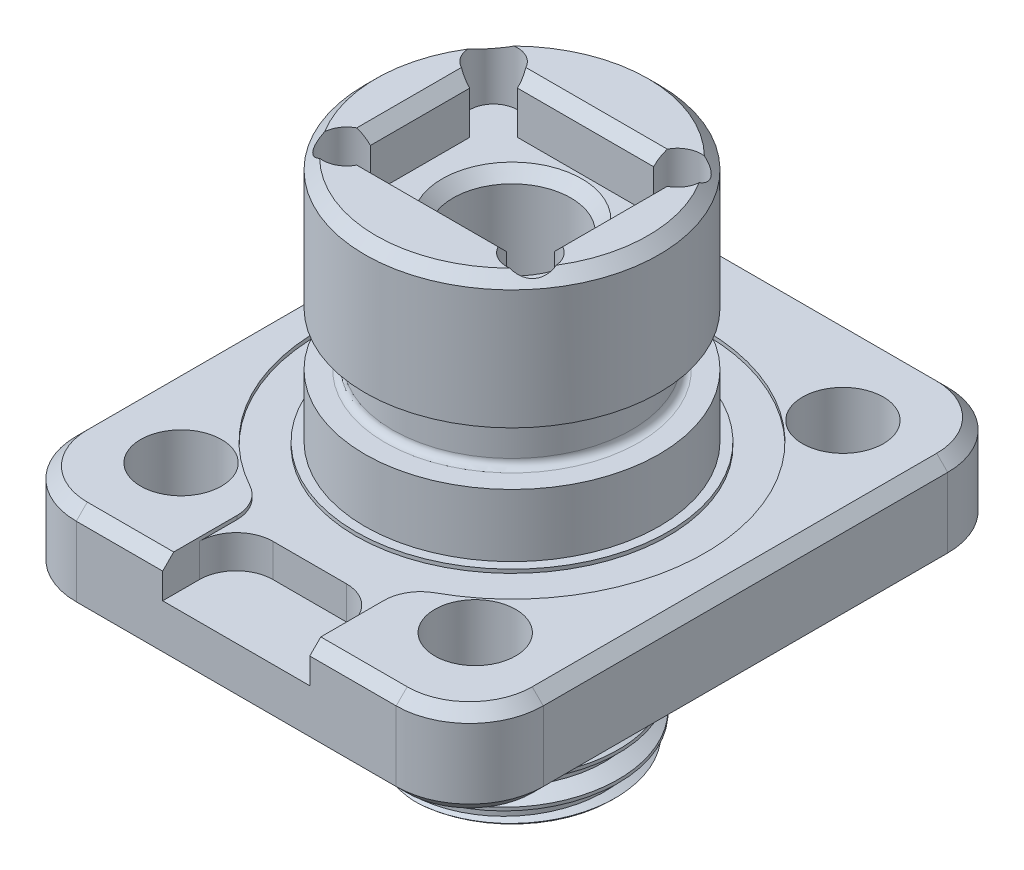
SolidWorks part; units mm, degrees
ref_plane "前视基准面" through (0, 0, 0) normal (0, 0, 1) x (1, 0, 0)
ref_plane "上视基准面" through (0, 0, 0) normal (0, 1, 0) x (1, 0, 0)
ref_plane "右视基准面" through (0, 0, 0) normal (1, 0, 0) x (0, 0, -1)
sketch "草图1" plane through (0, 0, 0) normal (1, 0, 0) x (0, 0, -1)
  line L0 (0, 0) -> (0, 4.5353) construction
  line L1 (-0.75, 0) -> (-1.6, 0)
  line L2 (-1.6, 0) -> (-1.6, -4)
  line L3 (-1.6, -4) -> (-2.1, -5)
  line L4 (-2.1, -5) -> (-3, -5)
  line L5 (-3, -5) -> (-3, -1.7)
  line L6 (-3, -1.7) -> (-2.5, -1.7)
  line L7 (-2.5, -1.7) -> (-2.5, -0.7)
  line L8 (-2.5, -0.7) -> (-5.4, -0.7)
  line L9 (-5.4, -0.7) -> (-5.4, 1)
  line L16 (-4, 1) -> (-1.25, 1)
  line L17 (-1.25, 1) -> (-0.75, 0.5)
  line L18 (-0.75, 0.5) -> (-0.75, 0)
  line L24 (-4, 1) -> (-5.4, 1)
  dimension "D1" = 0.75
  dimension "D2" = 0.5
  dimension "D3" = 1
  dimension "D4" = 45
  dimension "D5" = 1.6
  dimension "D6" = 3
  dimension "D7" = 5
  dimension "D8" = 1
  dimension "D9" = 0.5
  dimension "D10" = 0.7
  dimension "D11" = 3.3
  dimension "D12" = 0.5
  dimension "D13" = 5.4
revolve "旋转1" add sketch "草图1" angle 360 about L0
sketch "草图7" plane through (0, -0.7, 0) normal (0, 1, 0) x (1, 0, 0)
  line L0 (-6.35, 5.5) -> (-6.35, -5.5)
  line L1 (-4.35, -7.5) -> (4.35, -7.5)
  line L2 (6.35, -5.5) -> (6.35, 5.5)
  line L3 (4.35, 7.5) -> (-4.35, 7.5)
  line L4 (0, 0) -> (0, -4.1519) construction
  line L5 (0, 0) -> (-4.2498, 0) construction
  arc A0 (-6.35, -5.5) -> (-4.35, -7.5) centre (-4.35, -5.5) ccw
  arc A1 (4.35, -7.5) -> (6.35, -5.5) centre (4.35, -5.5) ccw
  arc A4 (6.35, 5.5) -> (4.35, 7.5) centre (4.35, 5.5) ccw
  arc A5 (-4.35, 7.5) -> (-6.35, 5.5) centre (-4.35, 5.5) ccw
  point P0 (0, 0)
  dimension "D1" = 2
  dimension "D2" = 15
  dimension "D4" = 12.7
extrude "凸台-拉伸1" add sketch "草图7" along normal blind 2
hole_wizard "M2 间隙槽口6" positions "草图8" profile "草图9" size "M2" standard "GB"
sketch "草图8" plane through (0, -0.7, 0) normal (0, -1, 0) x (-1, 0, 0)
  line L4 (0, 0) -> (0, 4.7467) construction
  line L6 (0, 0) -> (-5.268, 0) construction
  point P0 (-4, -5)
  point P2 (4, -5)
  point P6 (-4, 5)
  point P45 (4, 5)
  dimension "D1" = 10
  dimension "D2" = 8
sketch "草图9" plane through (4, -0.7, 5) normal (1, 0, 0) x (0, 0, -1)
  line L0 (0, 0) -> (0, 2)
  line L1 (0, 2) -> (1.1, 2)
  line L2 (1.1, 2) -> (1.1, 0)
  line L5 (1.1, 0) -> (0, 0)
  line L11 (0, -6.35) -> (0, 107.95) construction
  dimension "通孔孔直径" = 2.2
  dimension "通孔孔深度" = 2
chamfer "倒角1" distance 0.3 angle 45 1 edges at (0, -5, -3)
thread "螺纹线2" pitch 0.7 start angle 0, offset 1, length 3.6, pitch 0.7, diameter 6
ref_plane "基准面2" through (3, -5.7, 0) normal (0, 0, 1) x (1, 0, 0)
sketch "螺纹线轮廓2" plane through (3, -5.7, 0) normal (0, 0, 1) x (1, 0, 0)
  line L0 (0, 0) -> (0, 0.7) construction
  line L11 (0, 0) -> (0, 0.6125)
  line L12 (0, 0.6125) -> (-0.3789, 0.3937)
  line L13 (-0.3789, 0.3937) -> (-0.3789, 0.2187)
  line L15 (-0.3789, 0.2187) -> (0, 0)
  line L17 (-0.3789, 0.3062) -> (0, 0.3062) construction
  point P2 (0, 0)
  dimension "Pitch" = 0.7
  dimension "Profile_Angle" = 60
  dimension "Profile_Land" = 0.175
  dimension "Profile_Height" = 0.3789
sketch "草图10" plane through (0, 1.3, 0) normal (0, 1, 0) x (1, 0, 0)
  circle A0 centre (0, 0) radius 4
  dimension "D1" = 8
extrude "凸台-拉伸2" add sketch "草图10" along normal blind 2.5
sketch "草图11" plane through (0, -0.7, 0) normal (0, -1, 0) x (1, 0, 0)
  circle A1 centre (0, 0) radius 1.6
  circle A2 centre (0, 0) radius 1.6
  dimension "D1" = 0
extrude "切除-拉伸1" cut sketch "草图11" against normal blind 3.4
sketch "草图12" plane through (0, 2.7, 0) normal (0, -1, 0) x (1, 0, 0)
  circle A0 centre (0, 0) radius 1.6
  dimension "D1" = 3.2
extrude "切除-拉伸2" cut sketch "草图12" against normal through all
sketch "草图16" [suppressed] plane through (0, 3.8, 0) normal (0, 1, 0) x (1, 0, 0)
  circle A0 centre (0, 0) radius 2
  dimension "D1" = 4
chamfer "倒角5" [suppressed] distance 0.3 angle 45
sketch "草图17" plane through (0, -0.7, 0) normal (0, -1, 0) x (1, 0, 0)
  circle A0 centre (0, 0) radius 4
  circle A2 centre (0, 0) radius 3
  dimension "D1" = 8
  dimension "D2" = 6
extrude "切除-拉伸3" [suppressed] cut sketch "草图17" against normal blind 0.5
sketch "草图18" plane through (0, -0.7, 0) normal (0, -1, 0) x (1, 0, 0)
  line L4 (-4.35, -7.5) -> (4.35, -7.5)
  line L5 (-4.35, -7.5) -> (4.35, -7.5)
  line L6 (6.35, -5.5) -> (6.35, 5.5)
  line L7 (6.35, -5.5) -> (6.35, 5.5)
  line L8 (4.35, 7.5) -> (-4.35, 7.5)
  line L9 (4.35, 7.5) -> (-4.35, 7.5)
  line L10 (-6.35, 5.5) -> (-6.35, -5.5)
  line L11 (-6.35, 5.5) -> (-6.35, -5.5)
  circle A0 centre (0, 0) radius 2.5 construction
  circle A1 centre (0, 0) radius 2.5
  arc A4 (-6.35, -5.5) -> (-4.35, -7.5) centre (-4.35, -5.5) ccw
  arc A5 (-6.35, -5.5) -> (-4.35, -7.5) centre (-4.35, -5.5) ccw
  arc A6 (4.35, -7.5) -> (6.35, -5.5) centre (4.35, -5.5) ccw
  arc A7 (4.35, -7.5) -> (6.35, -5.5) centre (4.35, -5.5) ccw
  arc A8 (6.35, 5.5) -> (4.35, 7.5) centre (4.35, 5.5) ccw
  arc A9 (6.35, 5.5) -> (4.35, 7.5) centre (4.35, 5.5) ccw
  arc A10 (-4.35, 7.5) -> (-6.35, 5.5) centre (-4.35, 5.5) ccw
  arc A11 (-4.35, 7.5) -> (-6.35, 5.5) centre (-4.35, 5.5) ccw
  dimension "D1" = 0
extrude "切除-拉伸4" cut sketch "草图18" against normal blind 0.3
chamfer "倒角3" [suppressed] distance 0.3 angle 45
sketch "草图21" plane through (0, 3.8, 0) normal (0, 1, 0) x (1, 0, 0)
  circle A0 centre (0, 0) radius 1.6 construction
  circle A1 centre (0, 0) radius 4
  circle A2 centre (0, 0) radius 4
  circle A3 centre (0, 0) radius 1.6
  dimension "D1" = 0
extrude "凸台-拉伸4" add sketch "草图21" along normal blind 5
sketch "草图22" plane through (0, 8.8, 0) normal (0, 1, 0) x (1, 0, 0)
  line L1 (2.5, -2) -> (-2.5, -2)
  line L2 (2.5, -2) -> (2.5, 2)
  line L3 (2.5, 2) -> (-2.5, 2)
  line L4 (-2.5, -2) -> (-2.5, 2)
  line L5 (2.5, -2) -> (-2.5, 2) construction
  line L6 (2.5, 2) -> (-2.5, -2) construction
  point P0 (0, 0)
  dimension "D1" = 5
  dimension "D2" = 4
extrude "切除-拉伸5" cut sketch "草图22" against normal blind 1.46
sketch "草图24" plane through (0, 8.8, 0) normal (0, 1, 0) x (1, 0, 0)
  circle A0 centre (-2.5, -2) radius 0.65
  circle A1 centre (-2.5, 2) radius 0.65
  circle A2 centre (2.5, 2) radius 0.65
  circle A3 centre (2.5, -2) radius 0.65
  dimension "D1" = 1.3
extrude "切除-拉伸7" cut sketch "草图24" against normal up to surface (1.46 mm away)
chamfer "倒角7" distance 0.3 angle 45 1 edges at (0, 8.8, 4)
sketch "草图14" plane through (0, 0, 0) normal (1, 0, 0) x (0, 0, -1)
  line L0 (0, 0) -> (0, 8.8498) construction
  line L1 (4, 1.3) -> (4, 8.5) construction
  line L2 (4, 3.8) -> (3.25, 3.8)
  line L3 (4, 3.8) -> (4, 5.25)
  line L4 (4, 5.25) -> (3.25, 5.25)
  line L5 (3.25, 3.8) -> (3.25, 5.25)
  line L7 (5.5, 1.3) -> (-5.5, 1.3) construction
  dimension "D1" = 1.45
  dimension "D2" = 0.75
  dimension "D3" = 2.5
revolve "切除-旋转1" cut sketch "草图14" angle 360 about L0
sketch "草图25" plane through (0, 1.3, 0) normal (0, 1, 0) x (1, 0, 0)
  line L4 (-6.35, 5.5) -> (-6.35, -5.5)
  line L5 (-4.35, -7.5) -> (4.35, -7.5)
  line L6 (6.35, -5.5) -> (6.35, 5.5)
  line L7 (4.35, 7.5) -> (-4.35, 7.5)
  line L8 (-6.35, 5.5) -> (-6.35, -5.5)
  line L9 (-4.35, -7.5) -> (4.35, -7.5)
  line L10 (6.35, -5.5) -> (6.35, 5.5)
  line L11 (4.35, 7.5) -> (-4.35, 7.5)
  circle A0 centre (-4, 5) radius 1.1 construction
  circle A1 centre (4, 5) radius 1.1 construction
  circle A2 centre (-4, -5) radius 1.1 construction
  circle A3 centre (4, -5) radius 1.1 construction
  arc A4 (-4.35, 7.5) -> (-6.35, 5.5) centre (-4.35, 5.5) ccw
  arc A5 (-6.35, -5.5) -> (-4.35, -7.5) centre (-4.35, -5.5) ccw
  arc A6 (4.35, -7.5) -> (6.35, -5.5) centre (4.35, -5.5) ccw
  arc A7 (6.35, 5.5) -> (4.35, 7.5) centre (4.35, 5.5) ccw
  arc A8 (-4.35, 7.5) -> (-6.35, 5.5) centre (-4.35, 5.5) ccw
  arc A9 (-6.35, -5.5) -> (-4.35, -7.5) centre (-4.35, -5.5) ccw
  arc A10 (4.35, -7.5) -> (6.35, -5.5) centre (4.35, -5.5) ccw
  arc A11 (6.35, 5.5) -> (4.35, 7.5) centre (4.35, 5.5) ccw
  circle A12 centre (-4, 5) radius 1.1
  circle A13 centre (4, 5) radius 1.1
  circle A14 centre (-4, -5) radius 1.1
  circle A15 centre (4, -5) radius 1.1
  dimension "D1" = 0
extrude "凸台-拉伸5" add sketch "草图25" along normal blind 0.8
sketch "草图27" plane through (0, 2.1, 0) normal (0, 1, 0) x (1, 0, 0)
  line L0 (0, 0) -> (0, -8.353) construction
  line L1 (-4.35, -7.5) -> (4.35, -7.5) construction
  line L2 (2, -7.5) -> (-2, -7.5)
  line L3 (2, -7.5) -> (2, -4.8541)
  line L5 (-2, -7.5) -> (-2, -4.8541)
  circle A0 centre (0, 0) radius 4.25
  arc A1 (2, -4.8541) -> (-2, -4.8541) centre (0, 0) ccw
  dimension "D1" = 8.5
  dimension "D2" = 10.5
  dimension "D3" = 2
  dimension "D4" = 2
extrude "切除-拉伸8" cut sketch "草图27" against normal blind 0.1
sketch "草图28" plane through (0, 2, 0) normal (0, 1, 0) x (1, 0, 0)
  line L0 (-2, -4.8541) -> (-2, -7.5) construction
  line L1 (2, -7.5) -> (-2, -7.5)
  line L2 (2, -7.5) -> (2, -5.5)
  line L3 (2, -5.5) -> (-2, -5.5)
  line L4 (-2, -7.5) -> (-2, -5.5)
  dimension "D1" = 2
extrude "切除-拉伸9" cut sketch "草图28" against normal blind 0.9
fillet "圆角1" radius 1 2 edges at (-2, 1.55, 5.5) (2, 1.55, 5.5)
fillet "圆角2" radius 1 2 edges at (-2, 2.05, 4.8541) (2, 2.05, 4.8541)
chamfer "倒角6" distance 0.3 angle 45 17 edges at (-5.7642, -0.4, -6.9142) (0, -0.4, -7.5) (-6.35, -0.4, 0) (5.7642, -0.4, -6.9142) (-5.7642, -0.4, 6.9142) (6.35, -0.4, 0) (0, -0.4, 7.5) (5.7642, -0.4, 6.9142) (3.175, 2.1, 7.5) (5.7642, 2.1, 6.9142) (6.35, 2.1, 0) (5.7642, 2.1, -6.9142) (0, 2.1, -7.5) (-5.7642, 2.1, -6.9142) (-6.35, 2.1, 0) (-5.7642, 2.1, 6.9142) (-3.175, 2.1, 7.5)
chamfer "倒角8" distance 0.3 angle 45 4 edges at (-4, -0.4, 3.9) (4, -0.4, 3.9) (4, -0.4, -6.1) (-4, -0.4, -6.1)
sketch "草图29" plane through (0, 2.1, 0) normal (0, 1, 0) x (1, 0, 0)
  circle A0 centre (0, 0) radius 1
  dimension "D1" = 2
extrude "切除-拉伸10" cut sketch "草图29" against normal through all
sketch "草图30" plane through (0, 2.1, 0) normal (0, 1, 0) x (1, 0, 0)
  circle A0 centre (0, 0) radius 1 construction
  circle A1 centre (0, 0) radius 1.6
  circle A2 centre (0, 0) radius 1.6
  circle A3 centre (0, 0) radius 1
  dimension "D1" = 0
extrude "凸台-拉伸6" add sketch "草图30" along normal blind 1.4
sketch "草图31" plane through (0, 1.3, 0) normal (0, -1, 0) x (1, 0, 0)
  circle A0 centre (0, 0) radius 1 construction
  circle A1 centre (0, 0) radius 1.6
  circle A2 centre (0, 0) radius 1.6
  circle A3 centre (0, 0) radius 1
  dimension "D1" = 0
extrude "切除-拉伸11" cut sketch "草图31" against normal blind 1.4
fillet "圆角3" radius 0.2 2 edges at (0, 3.8, -3.25) (0, 5.25, -3.25)
chamfer "倒角9" distance 0.3 angle 45 1 edges at (0, 3.5, 1)
chamfer "倒角10" distance 0.3 angle 45 4 edges at (-2.5, 8.8, 0) (0, 8.8, -2) (0, 8.8, 2) (2.5, 8.8, 0)
chamfer "倒角11" distance 0.3 angle 45 1 edges at (0, 7.34, 1.6)
